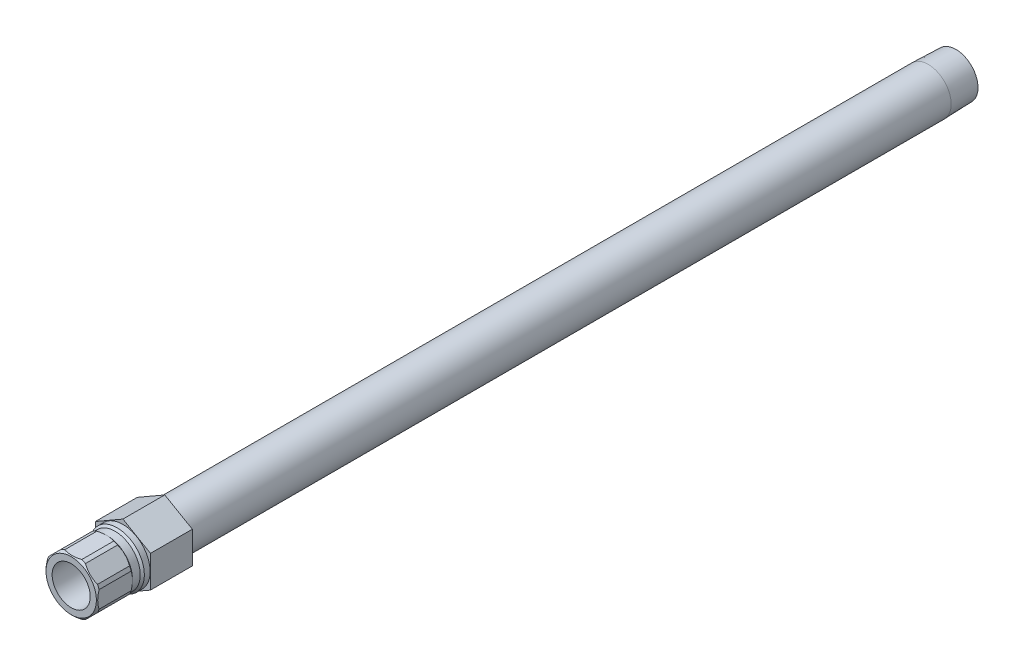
SolidWorks part; units mm, degrees
ref_plane "Front Plane" through (0, 0, 0) normal (0, 0, 1) x (1, 0, 0)
ref_plane "Top Plane" through (0, 0, 0) normal (0, 1, 0) x (1, 0, 0)
ref_plane "Right Plane" through (0, 0, 0) normal (1, 0, 0) x (0, 0, -1)
sketch "Sketch1" plane through (0, 0, 0) normal (1, 0, 0) x (0, 0, -1)
  line L0 (0, 0) -> (-22.479, 0) construction
  line L1 (-19.304, 7.112) -> (-19.304, 9.398)
  line L2 (-5.8166, 9.398) -> (-5.8166, 0) construction
  line L3 (-18.542, 10.16) -> (-6.5786, 10.16)
  line L4 (0, 8.5725) -> (0, 0) construction
  line L5 (-5.8166, 9.398) -> (-2.921, 9.398)
  line L6 (-2.159, 10.16) -> (0, 10.16)
  line L7 (0, 10.16) -> (0, 8.5725)
  line L8 (-5.8166, 9.398) -> (-6.5786, 10.16)
  line L9 (-2.921, 9.398) -> (-2.159, 10.16)
  line L10 (-19.304, 9.398) -> (-18.542, 10.16)
  line L11 (-19.304, 7.112) -> (-1.524, 7.112)
  line L12 (0, 8.5725) -> (300.5582, 8.5725)
  line L13 (300.5582, 8.5725) -> (310.896, 8.2494)
  line L14 (310.896, 8.2494) -> (310.896, 6.2611)
  line L15 (0, 10.16) -> (15.621, 10.16) construction
  line L16 (15.621, 10.16) -> (15.621, 7.112) construction
  line L17 (9.271, 0) -> (0, 0) construction
  line L18 (-1.524, 7.112) -> (-0.6731, 6.2611)
  line L19 (-0.6731, 6.2611) -> (310.896, 6.2611)
  dimension "D1" = 19.304
  dimension "D2" = 2.8956
  dimension "D3" = 0.762
  dimension "D4" = 45
  dimension "D5" = 13.4874
  dimension "D6" = 45
  dimension "D7" = 1.79
  dimension "D8" = 10.3378
  dimension "D9" = 330.2
  dimension "D10" = 3.175
  dimension "D11" = 34.925
  dimension "D12" = 14.224
  dimension "D13" = 17.145
  dimension "D14" = 20.32
  dimension "D15" = 12.5222
  dimension "D16" = 17.78
revolve "Revolve1" add sketch "Sketch1" angle 360 about L0
sketch "Sketch2" plane through (0, 0, 0) normal (0, 0, 1) x (1, 0, 0)
  line L1 (-10.287, 5.9392) -> (-10.287, -5.9392)
  line L2 (-10.287, -5.9392) -> (0, -11.8784)
  line L3 (0, -11.8784) -> (10.287, -5.9392)
  line L4 (10.287, -5.9392) -> (10.287, 5.9392)
  line L5 (10.287, 5.9392) -> (0, 11.8784)
  line L6 (0, 11.8784) -> (-10.287, 5.9392)
  circle A0 centre (0, 0) radius 10.287 construction
  circle A1 centre (0, 0) radius 6.2611 construction
  circle A2 centre (0, 0) radius 6.2611
  dimension "D1" = 20.574
extrude "Boss-Extrude1" add sketch "Sketch2" against normal up to vertex (15.621 mm away) from vertex at 0
sketch "Sketch3" plane through (0, 0, 0) normal (0, 0, 1) x (1, 0, 0)
  line L1 (9.652, -3.998) -> (9.652, 3.998)
  line L2 (9.652, 3.998) -> (3.998, 9.652)
  line L3 (3.998, 9.652) -> (-3.998, 9.652)
  line L4 (-3.998, 9.652) -> (-9.652, 3.998)
  line L5 (-9.652, 3.998) -> (-9.652, -3.998)
  line L6 (-9.652, -3.998) -> (-3.998, -9.652)
  line L7 (-3.998, -9.652) -> (3.998, -9.652)
  line L8 (3.998, -9.652) -> (9.652, -3.998)
  circle A0 centre (0, 0) radius 9.652 construction
  dimension "D1" = 19.304
extrude "Cut-Extrude1" cut sketch "Sketch3" along normal through all from vertex at 5.8166 flip side to cut
